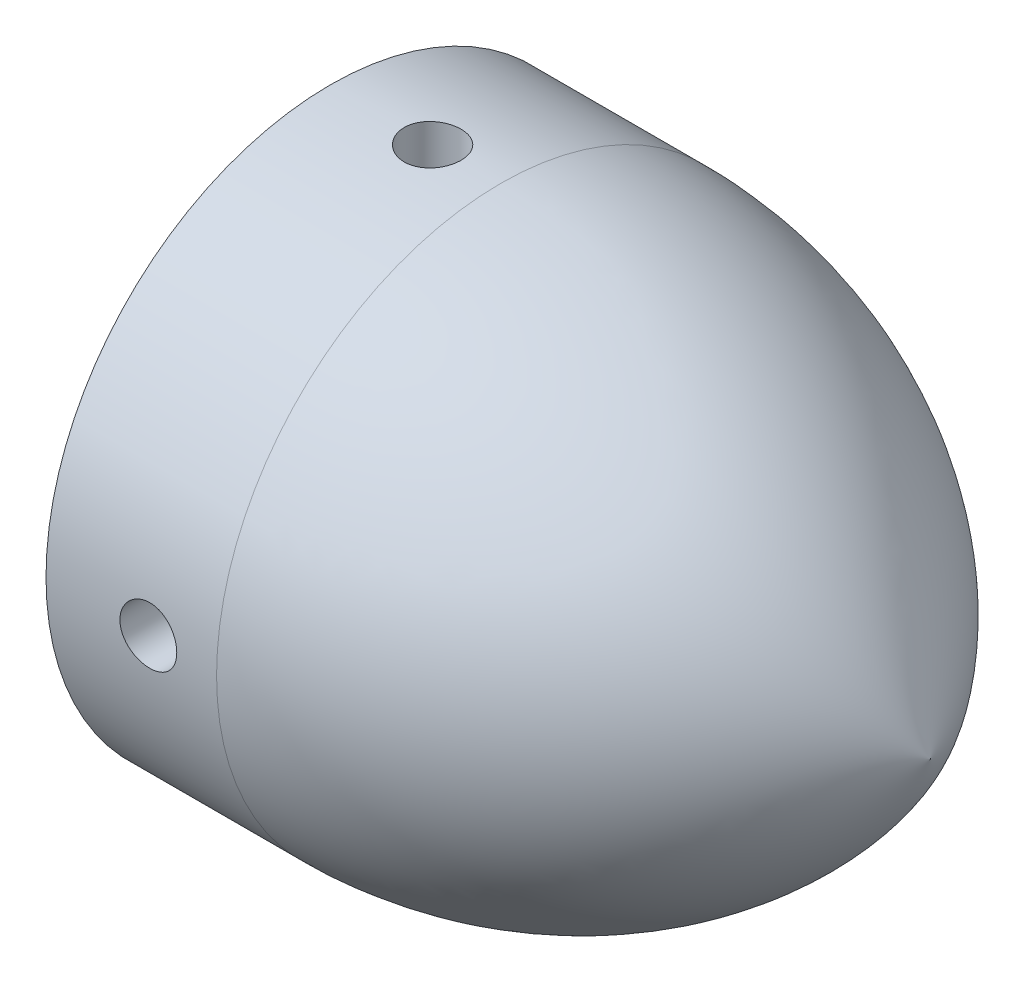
SolidWorks part; units mm, degrees
ref_plane "Front Plane" through (0, 0, 0) normal (0, 0, 1) x (1, 0, 0)
ref_plane "Top Plane" through (0, 0, 0) normal (0, 1, 0) x (1, 0, 0)
ref_plane "Right Plane" through (0, 0, 0) normal (1, 0, 0) x (0, 0, -1)
sketch "Sketch1" plane through (0, 0, 0) normal (0, 0, 1) x (1, 0, 0)
  line L0 (0, 0) -> (105.4983, 0)
  line L1 (0, 0) -> (0, 50)
  line L2 (0, 50) -> (30, 50)
  arc A0 (30, 50) -> (105.4983, 0) centre (30, -32) cw
  dimension "D3" = 30
  dimension "D4" = 105.4983
  dimension "D2" = 82
  dimension "D1" = 50
revolve "Revolve1" add sketch "Sketch1" angle 360 about L0
sketch "Sketch2" plane through (0, 0, 0) normal (-1, 0, 0) x (0, 0, 1)
  circle A0 centre (0, 0) radius 40
  dimension "D1" = 80
extrude "Extrude1" cut sketch "Sketch2" against normal blind 10
sketch "Sketch3" plane through (10, 0, 0) normal (-1, 0, 0) x (0, 0, 1)
  point P0 (0, 0)
hole_wizard "M8 Tapped Hole1" positions "3DSketch1" profile "Sketch4" tap size "M8" standard "ISO"
sketch3d "3DSketch1"
  point P0 (10, 0, 0)
sketch "Sketch4" plane through (10, 0, 0) normal (0, 1, 0) x (0, 0, 1)
  line L0 (0, 0) -> (0, 22.0429)
  line L1 (0, 22.0429) -> (3.4, 20)
  line L2 (3.4, 20) -> (3.4, 0)
  line L5 (3.4, 0) -> (0, 0)
  line L10 (0, 22.0429) -> (-3.4, 20) construction
  line L11 (0, -6.35) -> (0, 107.95) construction
  dimension "Tap Drill Dia." = 6.8
  dimension "Tap Drill Depth" = 20
  dimension "Drill Angle" = 118
ref_plane "Plane1" through (0, 0, 50) normal (0, 0, 1) x (1, 0, 0)
sketch "Sketch5" plane through (0, 0, 50) normal (0, 0, 1) x (1, 0, 0)
  line L0 (0, 50) -> (0, -50) construction
  line L1 (30, 50) -> (0, 50) construction
  circle A0 centre (18, 0) radius 5
  dimension "D3" = 10
  dimension "D1" = 18
  dimension "D2" = 50
extrude "Extrude2" cut sketch "Sketch5" against normal blind 20
pattern_circular "CirPattern1" count 4 over 360 about axis through (0, 0, 0) along (1, 0, 0) of "Extrude2"
